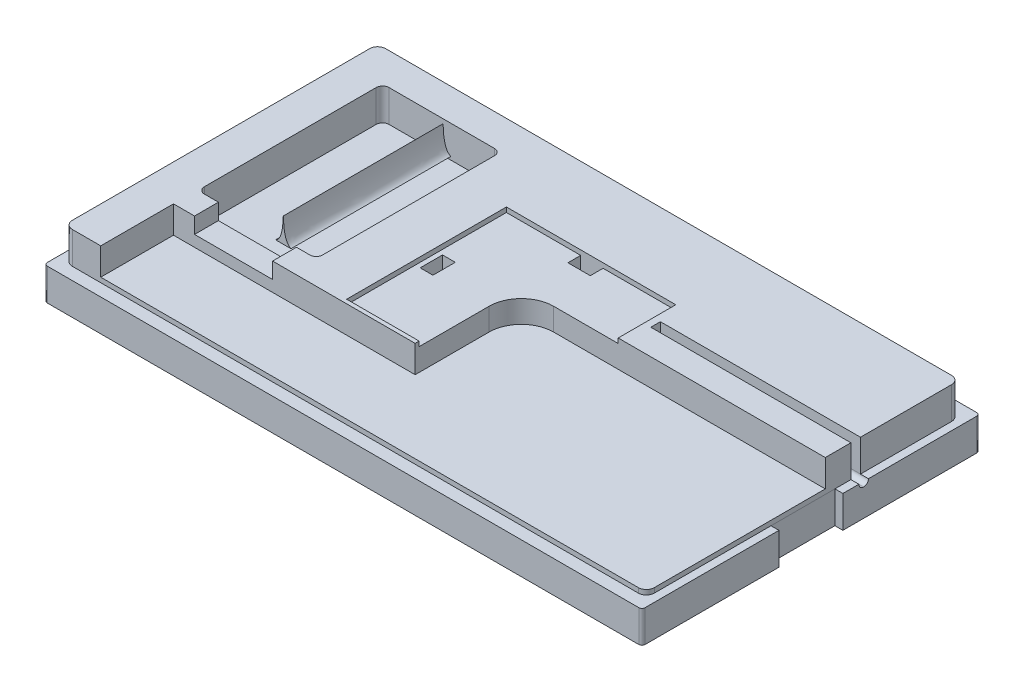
SolidWorks part; units mm, degrees
ref_plane "Front Plane" through (0, 0, 0) normal (0, 0, 1) x (1, 0, 0)
ref_plane "Top Plane" through (0, 0, 0) normal (0, 1, 0) x (1, 0, 0)
ref_plane "Right Plane" through (0, 0, 0) normal (1, 0, 0) x (0, 0, -1)
sketch "Sketch4" plane through (0, 0, 0) normal (0, 1, 0) x (1, 0, 0)
  line L1 (-92.55, 52.88) -> (92.55, 52.88)
  line L2 (-93.55, 51.88) -> (-93.55, -51.88)
  line L3 (-92.55, -52.88) -> (92.55, -52.88)
  line L4 (93.55, 51.88) -> (93.55, -51.88)
  line L5 (-93.55, 52.88) -> (93.55, -52.88) construction
  line L6 (-93.55, -52.88) -> (93.55, 52.88) construction
  arc A0 (-93.55, -51.88) -> (-92.55, -52.88) centre (-92.55, -51.88) ccw
  arc A1 (-92.55, 52.88) -> (-93.55, 51.88) centre (-92.55, 51.88) ccw
  arc A2 (92.55, 52.88) -> (93.55, 51.88) centre (92.55, 51.88) cw
  arc A3 (92.55, -52.88) -> (93.55, -51.88) centre (92.55, -51.88) ccw
  point P0 (0, 0)
  dimension "D3" = 1
  dimension "D4" = 1
  dimension "D1" = 105.76
  dimension "D2" = 187.1
sketch "Sketch8" plane through (0, 0, 0) normal (0, 1, 0) x (1, 0, 0)
  line L1 (-93.55, -10) -> (-91.05, -10)
  line L2 (-93.55, -10) -> (-93.55, 10)
  line L3 (-93.55, 10) -> (-91.05, 10)
  line L5 (-91.05, -10) -> (-91.05, 10)
  line L6 (-93.55, -10) -> (-91.05, 10) construction
  line L7 (-93.55, 10) -> (-91.05, -10) construction
  point P8 (-92.3, 0)
sketch "Sketch9" plane through (0, 0, 0) normal (0, 1, 0) x (1, 0, 0)
  line L1 (-88.5602, 49.016) -> (88.5602, 49.016)
  line L2 (-91.0602, 46.516) -> (-91.0602, -46.516)
  line L3 (-88.5602, -49.016) -> (88.5602, -49.016)
  line L4 (91.0602, 46.516) -> (91.0602, -46.516)
  line L5 (-91.0602, 49.016) -> (91.0602, -49.016) construction
  line L6 (-91.0602, -49.016) -> (91.0602, 49.016) construction
  arc A0 (-88.5602, 49.016) -> (-91.0602, 46.516) centre (-88.5602, 46.516) ccw
  arc A1 (-91.0602, -46.516) -> (-88.5602, -49.016) centre (-88.5602, -46.516) ccw
  arc A2 (88.5602, -49.016) -> (91.0602, -46.516) centre (88.5602, -46.516) ccw
  arc A3 (88.5602, 49.016) -> (91.0602, 46.516) centre (88.5602, 46.516) cw
  point P0 (0, 0)
  dimension "D1" = 2.5
extrude "Boss-Extrude3" add sketch "Sketch9" along normal blind 20
ref_plane "Plane10" through (0, 20, 0) normal (0, 1, 0) x (1, 0, 0)
sketch "Sketch13" plane through (0, 20, 0) normal (0, 1, 0) x (1, 0, 0)
  line L1 (6.0602, 6.984) -> (91.0602, 6.984)
  line L2 (-4.0556, -3.1318) -> (-4.0556, -49.016)
  line L3 (-4.0556, -49.016) -> (91.0602, -49.016)
  line L4 (91.0602, 6.984) -> (91.0602, -49.016)
  arc A0 (6.0602, 6.984) -> (-4.0556, -3.1318) centre (6.0602, -3.1318) ccw
  point P0 (41.9421, -21)
extrude "Cut-Extrude3" cut sketch "Sketch13" against normal blind 8.5 contours L2 L3 L4 L1 A0
sketch "Sketch15" plane through (0, 20, 0) normal (0, 1, 0) x (1, 0, 0)
  line L0 (6.0602, 6.984) -> (91.0602, 6.984) construction
  line L1 (-26.7491, 25) -> (26.2509, 25)
  line L2 (-26.7491, 25) -> (-26.7491, -25)
  line L3 (-26.7491, -25) -> (26.2509, -25)
  line L4 (26.2509, 25) -> (26.2509, -25)
  line L5 (-26.7491, 25) -> (26.2509, -25) construction
  line L6 (-26.7491, -25) -> (26.2509, 25) construction
  line L7 (-4.0556, -3.1318) -> (-4.0556, -49.016) construction
  point P0 (0, 0)
  point P7 (-0.2491, 0)
  dimension "D1" = 18.016
  dimension "D2" = 22.6935
sketch "Sketch16" plane through (0, 20, 0) normal (0, 1, 0) x (1, 0, 0)
  line L1 (-25.2491, 3.5) -> (-21.2491, 3.5)
  line L2 (-25.2491, 3.5) -> (-25.2491, -3.5)
  line L3 (-25.2491, -3.5) -> (-21.2491, -3.5)
  line L4 (-21.2491, 3.5) -> (-21.2491, -3.5)
  line L5 (-25.2491, 3.5) -> (-21.2491, -3.5) construction
  line L6 (-25.2491, -3.5) -> (-21.2491, 3.5) construction
  line L7 (-26.7491, 25) -> (26.2509, 25) construction
  line L8 (-3.5, 21) -> (3.5, 21)
  line L9 (-3.5, 21) -> (-3.5, 25)
  line L10 (-3.5, 25) -> (3.5, 25)
  line L11 (3.5, 21) -> (3.5, 25)
  point P0 (-23.2491, 0)
  point P14 (0, 25)
  point P27 (-23.2491, 0)
  dimension "D1" = 7
  dimension "D2" = 21.5
sketch "Sketch17" plane through (0, 20, 0) normal (0, 1, 0) x (1, 0, 0)
  line L1 (-77.5, 39) -> (-44.5, 39)
  line L2 (-79.5, 37) -> (-79.5, -16.7708)
  line L3 (-77.5, -18.7708) -> (-44.5, -18.7708)
  line L4 (-42.5, 37) -> (-42.5, -16.7708)
  arc A0 (-79.5, -16.7708) -> (-77.5, -18.7708) centre (-77.5, -16.7708) ccw
  arc A1 (-44.5, -18.7708) -> (-42.5, -16.7708) centre (-44.5, -16.7708) ccw
  arc A2 (-44.5, 39) -> (-42.5, 37) centre (-44.5, 37) cw
  arc A3 (-79.5, 37) -> (-77.5, 39) centre (-77.5, 37) cw
  point P0 (-60.4582, 13.6077)
  dimension "D1" = 2
extrude "Cut-Extrude5" cut sketch "Sketch17" against normal blind 10 contours L2 A0 L3 A1 L4 A2 L1 A3
sketch "Sketch24" plane through (0, 0, -39) normal (0, 0, 1) x (1, 0, 0)
  line L0 (-60.5793, 18.6439) -> (-60.5793, 17.2928) construction
  line L3 (-62.9842, 10.9699) -> (-58.1744, 10.9699)
  spline S0 degree 3 poles (-60.5793, 18.6439) (-60.7064, 14.4713) (-61.3034, 11.794) (-62.9842, 10.9699) knots 0 0 0 0 1 1 1 1
  spline S1 degree 3 poles (-60.5793, 18.6439) (-60.4522, 14.4713) (-59.8552, 11.794) (-58.1744, 10.9699) knots 0 0 0 0 1 1 1 1
extrude "Boss-Extrude10" add sketch "Sketch24" along normal blind 50 contours S0 L3 S1
sketch "Sketch27" plane through (0, 20, 0) normal (0, 1, 0) x (1, 0, 0)
  line L0 (-4.0556, -3.1318) -> (-4.0556, -49.016) construction
  line L1 (-79.6944, -26.25) -> (-4.0556, -26.25)
  line L2 (-79.6944, -26.25) -> (-79.6944, -49.0957)
  line L3 (-79.6944, -49.0957) -> (-4.0556, -49.0957)
  line L4 (-4.0556, -26.25) -> (-4.0556, -49.0957)
  line L5 (-79.6944, -26.25) -> (-4.0556, -49.0957) construction
  line L6 (-79.6944, -49.0957) -> (-4.0556, -26.25) construction
  line L7 (-4.0556, -3.1318) -> (-4.0556, -49.016) construction
  point P0 (-41.875, -37.6728)
extrude "Cut-Extrude7" cut sketch "Sketch27" against normal blind 8.5 contours L2 L3 L4 L1
sketch "Sketch29" plane through (0, 20, 0) normal (0, 1, 0) x (1, 0, 0)
  line L1 (-73.1104, -17.3283) -> (-48.6854, -17.3283)
  line L2 (-73.1104, -17.3283) -> (-73.1104, -28.1121)
  line L3 (-73.1104, -28.1121) -> (-48.6854, -28.1121)
  line L4 (-48.6854, -17.3283) -> (-48.6854, -28.1121)
  line L5 (-73.1104, -17.3283) -> (-48.6854, -28.1121) construction
  line L6 (-73.1104, -28.1121) -> (-48.6854, -17.3283) construction
  point P0 (-60.8979, -22.7202)
extrude "Cut-Extrude8" cut sketch "Sketch29" against normal blind 5
extrude "Cut-Extrude12" cut sketch "Sketch16" against normal blind 8 contours L10 L11 L8 L9 | L3 L4 L1 L2
extrude "Cut-Extrude13" cut sketch "Sketch15" against normal blind 1.5
extrude "Boss-Extrude11" add sketch "Sketch4" along normal blind 10 contours L2 A0 L3 A3 L4 A2 L1 A1
extrude "Cut-Extrude14" cut sketch "Sketch8" along normal blind 10 contours L2 L3 L5 L1
mirror "Mirror2" about plane through (0, 0, 0) normal (1, 0, 0) of "Cut-Extrude14"
sketch "Sketch33" plane through (0, 20, 0) normal (0, 1, 0) x (1, 0, 0)
  line L0 (93.55, 10) -> (91.0602, 10) construction
  line L1 (28.4421, 18) -> (98.7229, 18)
  line L2 (28.4421, 18) -> (28.4421, 15)
  line L3 (28.4421, 15) -> (98.7229, 15)
  line L4 (98.7229, 18) -> (98.7229, 15)
  point P4 (0, 0)
  point P6 (0, 0)
  point P7 (0, 0)
  point P8 (0, 0)
  point P9 (0, 0)
  point P10 (0, 0)
  point P15 (92.3051, 10)
  dimension "D1" = 5
extrude "Cut-Extrude47" cut sketch "Sketch33" against normal blind 11.5 contours L3 L4 L1 L2
fillet "Fillet3" radius 1.5 1 edges at (60.9961, 8.5, -18)
fillet "Fillet4" radius 1.5 1 edges at (60.9961, 8.5, -15)
